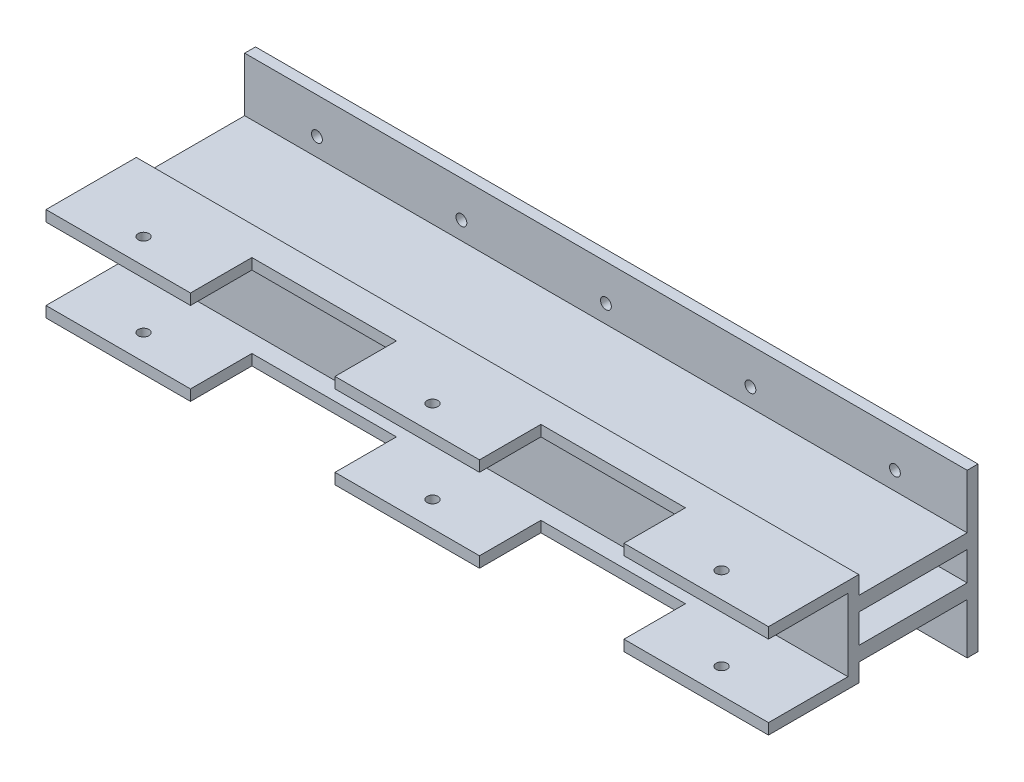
SolidWorks part; units mm, degrees
ref_plane "前视基准面" through (0, 0, 0) normal (0, 0, 1) x (1, 0, 0)
ref_plane "上视基准面" through (0, 0, 0) normal (0, 1, 0) x (1, 0, 0)
ref_plane "右视基准面" through (0, 0, 0) normal (1, 0, 0) x (0, 0, -1)
other "Configuration Table"
sketch "草图1" plane through (0, 0, 0) normal (0, 1, 0) x (1, 0, 0)
  line L1 (-100, -12.5) -> (100, -12.5)
  line L2 (-100, -12.5) -> (-100, 12.5)
  line L3 (-100, 12.5) -> (100, 12.5)
  line L4 (100, -12.5) -> (100, 12.5)
  line L5 (-100, -12.5) -> (100, 12.5) construction
  line L6 (-100, 12.5) -> (100, -12.5) construction
  point P0 (0, 0)
extrude "凸台-拉伸1" add sketch "草图1" along normal blind 3
sketch "草图2" plane through (0, 0, 0) normal (0, -1, 0) x (1, 0, 0)
  line L0 (100, 12.5) -> (100, -12.5) construction
  line L1 (-100, -12.5) -> (100, -12.5)
  line L2 (-100, -12.5) -> (-100, -9.5)
  line L3 (-100, -9.5) -> (100, -9.5)
  line L4 (100, -12.5) -> (100, -9.5)
extrude "凸台-拉伸2" add sketch "草图2" along normal blind 20
sketch "草图3" plane through (0, -20, 0) normal (0, -1, 0) x (1, 0, 0)
  line L1 (-100, 12.5) -> (100, 12.5)
  line L2 (-100, 12.5) -> (-100, -12.5)
  line L3 (-100, -12.5) -> (100, -12.5)
  line L4 (100, 12.5) -> (100, -12.5)
extrude "凸台-拉伸4" add sketch "草图3" along normal blind 3
sketch "草图4" plane through (0, 3, 0) normal (0, 1, 0) x (1, 0, 0)
  circle A0 centre (-80, -5.5) radius 1.5
  circle A1 centre (-40, -5.5) radius 1.5
  circle A2 centre (0, -5.5) radius 1.5
  circle A3 centre (40, -5.5) radius 1.5
  circle A4 centre (80, -5.5) radius 1.5
  dimension "D1" = 5
extrude "切除-拉伸1" cut sketch "草图4" against normal up to surface (26 mm away)
sketch "草图5" plane through (0, 0, -12.5) normal (0, 0, -1) x (-1, 0, 0)
  line L0 (-100, -2) -> (-100, -6)
  line L1 (-100, 3) -> (-100, -23) construction
  line L2 (-100, -18) -> (-100, -14)
  line L3 (-100, -6) -> (100, -6)
  line L4 (100, 3) -> (100, -23) construction
  line L5 (-100, -14) -> (100, -14)
  line L6 (-100, -2) -> (100, -2)
  line L8 (-100, -18) -> (100, -18)
  line L9 (100, -2) -> (100, -6)
  line L10 (100, -14) -> (100, -18)
extrude "凸台-拉伸5" add sketch "草图5" along normal blind 30
sketch "草图6" plane through (0, 0, -42.5) normal (0, 0, -1) x (-1, 0, 0)
  line L2 (-100, 3) -> (100, 3) construction
  line L3 (-100, -32) -> (100, -32)
  line L9 (-100, -32) -> (-100, 13)
  line L10 (-100, 13) -> (100, 13)
  line L11 (100, -32) -> (100, 13)
  line L12 (100, -23) -> (-100, -23) construction
  circle A0 centre (-80, 3) radius 1.5
  circle A1 centre (-80, -23) radius 1.5
  circle A2 centre (-40, 3) radius 1.5
  circle A3 centre (-40, -23) radius 1.5
  circle A4 centre (0, 3) radius 1.5
  circle A5 centre (0, -23) radius 1.5
  circle A6 centre (40, 3) radius 1.5
  circle A7 centre (40, -23) radius 1.5
  circle A8 centre (80, 3) radius 1.5
  circle A9 centre (80, -23) radius 1.5
  dimension "D1" = 5
extrude "凸台-拉伸6" add sketch "草图6" along normal blind 3
sketch "草图7" plane through (0, 3, 0) normal (0, 1, 0) x (1, 0, 0)
  line L0 (-60, 4.5) -> (-60, -12.5)
  line L2 (0, -24.75) -> (0, 24.75) construction
  line L3 (20, 4.5) -> (20, -12.5)
  line L4 (60, 4.5) -> (20, 4.5)
  line L5 (-100, -12.5) -> (100, -12.5) construction
  line L6 (-60, 4.5) -> (-20, 4.5)
  line L7 (-20, 4.5) -> (-20, -12.5)
  line L8 (60, 4.5) -> (60, -12.5)
  line L9 (-60, -12.5) -> (-20, -12.5)
  line L10 (20, -12.5) -> (60, -12.5)
extrude "切除-拉伸2" cut sketch "草图7" against normal up to surface (26 mm away)
sketch "草图9" plane through (0, 0, -45.5) normal (0, 0, -1) x (-1, 0, 0)
  line L1 (-100, -32) -> (100, -32) construction
  line L3 (-18, -20) -> (-18, -32)
  line L4 (0, -20) -> (-18, -20)
  line L5 (0, -20) -> (18, -20)
  line L9 (-18, -32) -> (18, -32)
  line L10 (18, -32) -> (18, -20)
extrude "切除-拉伸3" cut sketch "草图9" against normal up to surface (3 mm away)
